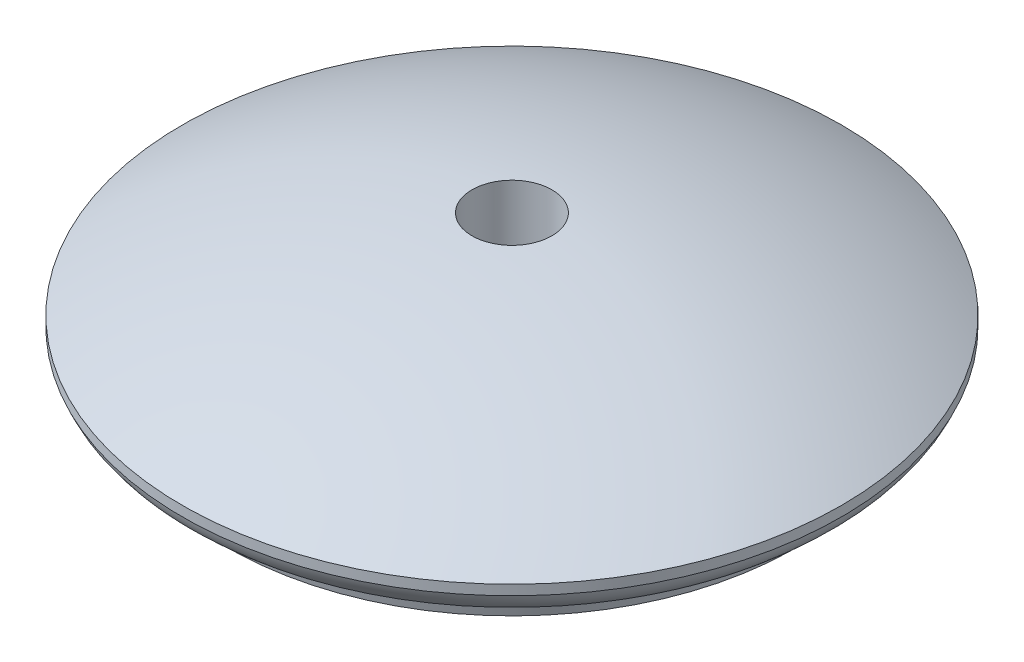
SolidWorks part; units mm, degrees
ref_plane "Alzado" through (0, 0, 0) normal (0, 0, 1) x (1, 0, 0)
ref_plane "Planta" through (0, 0, 0) normal (0, 1, 0) x (1, 0, 0)
ref_plane "Vista lateral" through (0, 0, 0) normal (1, 0, 0) x (0, 0, -1)
sketch "Croquis1" plane through (0, 0, 0) normal (0, 0, 1) x (1, 0, 0)
  line L0 (0, 0) -> (0, 75) construction
  line L1 (0, 0) -> (142, 0)
  line L2 (0, 0) -> (0, 10)
  line L3 (0, 10) -> (143.8147, 10)
  line L5 (0, 10) -> (0, 25)
  line L6 (20, 25) -> (165, 25)
  line L7 (165, 25) -> (165, 30)
  line L8 (142, 0) -> (143.8147, 10)
  line L9 (165, 30) -> (20, 30)
  line L12 (20, 75) -> (20, 10)
  arc A0 (143.8147, 10) -> (165, 25) centre (143.8147, 32.4606) ccw
  arc A1 (165, 30) -> (20, 74.384) centre (0, -250) ccw
  point P16 (0, 0)
  dimension "D2" = 10
  dimension "D5" = 165
  dimension "D6" = 75
  dimension "D4" = 165
  dimension "D1" = 142
  dimension "D3" = 15
  dimension "D7" = 5
revolve "Revolución1" add sketch "Croquis1" angle 360 about L0
